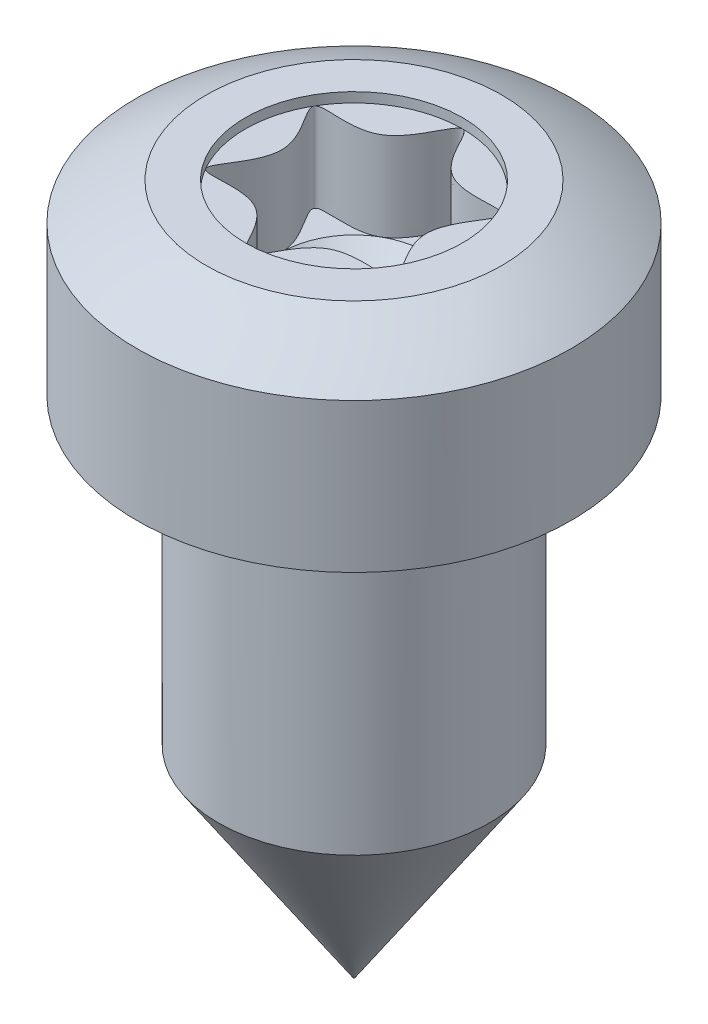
SolidWorks part; units mm, degrees
ref_plane "Front" through (0, 0, 0) normal (0, 0, 1) x (1, 0, 0)
ref_plane "Top" through (0, 0, 0) normal (0, 1, 0) x (1, 0, 0)
ref_plane "Right" through (0, 0, 0) normal (1, 0, 0) x (0, 0, -1)
sketch "Sketch1" plane through (0, 0, 0) normal (0, 0, 1) x (1, 0, 0)
  line L0 (0, 0) -> (0, 9.001) construction
  line L1 (0, 0) -> (0, 8.9)
  line L2 (0, 8.9) -> (2.8, 8.9)
  line L3 (2.8, 8.9) -> (2.8, 6.5)
  line L4 (2.8, 6.5) -> (1.75, 6.5)
  line L5 (1.75, 6.5) -> (1.75, 0)
  line L6 (1.75, 0) -> (0, 0)
  line L7 (0, 8.9) -> (-1.1, 8.9) construction
  line L8 (2.8, 6.5) -> (2.8, 5.4) construction
  line L9 (0, 0) -> (1.75, 2.6) construction
  dimension "head_dia" = 5.6
  dimension "head_ht" = 2.4
  dimension "length" = 6.5
  dimension "dia" = 3.5
  dimension "pitch" = 1.1
  dimension "thread_gap" = 1.1
  dimension "end_length" = 2.6
revolve "Body-Revolve" add sketch "Sketch1" angle 360 about L1
sketch "Sketch3" plane through (0, 0, 0) normal (0, 0, 1) x (1, 0, 0)
  line L0 (2.8, 8.42) -> (0, 4.2775) construction
  line L2 (2.8, 6.5) -> (2.8, 8.9) construction
  line L3 (0, 0) -> (0, 8.9) construction
  line L4 (2.8, 8.9) -> (-2.8, 8.9) construction
  line L5 (0, 9.2775) -> (0, 10.4044)
  line L6 (0, 10.4044) -> (5, 10.4044)
  line L7 (5, 10.4044) -> (5, 4.2775)
  arc A0 (5, 4.2775) -> (0, 9.2775) centre (0, 4.2775) ccw
  dimension "D1" = 0.48
  dimension "sphere_rad" = 5
  dimension "D2" = 1.1268
revolve "Head-Cut-Revolve" cut sketch "Sketch3" angle 360 about axis through (0, 0, 0) along (0, 1, 0)
sketch "Sketch4" plane through (0, 8.9, 0) normal (0, 1, 0) x (-1, 0, 0)
  line L0 (0, 0) -> (0, -1.54)
  line L1 (0, 0) -> (-0.7, -1.2124)
  circle A0 centre (0, 0) radius 1.4
  circle A1 centre (0, 0) radius 0.9333
  spline S0 degree 3 poles (0.302, -0.523) (0, -1.8385) (-0.302, -0.523) (-1.5922, -0.9193) (-0.6039, 0) (-1.5922, 0.9193) (-0.302, 0.523) (0, 1.8385) (0.302, 0.523) (1.5922, 0.9193) (0.6039, 0) (1.5922, -0.9193) (0.302, -0.523) (0, -1.8385) (-0.302, -0.523) knots -0.25 -0.166667 -0.083333 0 0.083333 0.166667 0.25 0.333333 0.416667 0.5 0.583333 0.666667 0.75 0.833333 0.916667 1 1.083333 1.166667 1.25 only from (0, -1.4) to (0, -1.4)
  point P4 (0, -1.4)
  point P7 (-0.4667, -0.8083)
  point P10 (-1.2124, -0.7)
  point P11 (-1.2124, 0.7)
  point P12 (0, 1.4)
  point P13 (1.2124, 0.7)
  point P14 (1.2124, -0.7)
  point P15 (-0.9333, 0)
  point P16 (-0.4667, 0.8083)
  point P17 (0.4667, 0.8083)
  point P18 (0.9333, 0)
  point P19 (0.4667, -0.8083)
  dimension "D1" = 1.8667
  dimension "socket-dia" = 2.8
  dimension "D2" = 30
  dimension "D3" = 1.54
extrude "Recess-Cut-Extrude1" cut sketch "Sketch4" against normal blind 1.27 contours S0
sketch "Sketch5" plane through (0, 8.9, 0) normal (0, 1, 0) x (-1, 0, 0)
  circle A0 centre (0, 0) radius 1.4
  dimension "D1" = 2.8
extrude "Recess-Cut-Extrude2" cut sketch "Sketch5" against normal blind 0.127
sketch "Sketch6" plane through (0, 0, 0) normal (0, 0, 1) x (1, 0, 0)
  line L0 (0, 7.63) -> (0.9333, 7.63)
  line L2 (0, 0) -> (0, 8.9) construction
  line L4 (1.2177, 7.63) -> (-1.2177, 7.63) construction
  line L5 (0.9333, 7.63) -> (0, 6.74)
  line L6 (0, 6.74) -> (0, 7.63)
  line L7 (1.4, 8.9) -> (-1.4, 8.9) construction
  dimension "D1" = 2.16
  dimension "D2" = 0.9333
revolve "Drill-Cut-Revolve" cut sketch "Sketch6" angle 360 about axis through (0, 0, 0) along (0, 1, 0)
fillet "Fillet1" radius 0.1 1 edges at (0, 6.5, -1.75)
sketch "Sketch7" plane through (0, 0, 0) normal (0, 0, 1) x (1, 0, 0)
  line L0 (1.75, 0) -> (1.75, 2.6)
  line L1 (1.75, 0) -> (1.75, 6.4) construction
  line L2 (1.75, 2.6) -> (0.01, 0)
  line L3 (-1.75, 0) -> (1.75, 0) construction
  line L4 (0.01, 0) -> (1.75, 0)
  dimension "D1" = 0.01
  dimension "D2" = 2.6
revolve "Body-Cut-Revolve" cut sketch "Sketch7" angle 360 about axis through (0, 0, 0) along (0, 1, 0)
sketch "Sketch8" plane through (0, 0, 0) normal (0, 0, 1) x (1, 0, 0)
  line L0 (1.75, 5.4) -> (1.75, 4.7125)
  line L1 (1.75, 2.6) -> (1.75, 6.4) construction
  line L2 (1.75, 4.7125) -> (1.1546, 5.0563)
  line L3 (1.1546, 5.0563) -> (1.75, 5.4)
  line L4 (-2.8, 6.5) -> (2.8, 6.5) construction
  line L5 (0, 0) -> (0, 8.9) construction
  dimension "D1" = 1.1
  dimension "D2" = 1.1546
revolve "ThreadSchematic" [suppressed] cut sketch "Sketch8" angle 360 about axis through (0, 0, 0) along (0, 1, 0)
pattern_linear "ThdSchPat" [suppressed] count 5 spacing 1.1 along (0, 1, 0)
equation "\"D1@ThreadCosmetic\" = \"length@Sketch1\" - \"thread_gap@Sketch1\""
equation "\"D2@ThreadCosmetic\" = \"dia@Sketch1\" - \"pitch@Sketch1\" * 1.0825"
equation "\"D1@Sketch3\" = 0.2 * \"head_ht@Sketch1\""
equation "\"D1@Sketch4\" = \"socket-dia@Sketch4\" / 1.5"
equation "\"D3@Sketch4\" = \"socket-dia@Sketch4\" / 2 * 1.1"
equation "\"D1@Sketch5\" = \"socket-dia@Sketch4\""
equation "\"D1@Recess-Cut-Extrude2\" = 0.1 * \"socket-dep@Recess-Cut-Extrude1\""
equation "\"D1@Sketch6\" = 0.9 * \"head_ht@Sketch1\""
equation "\"D2@Sketch6\" = \"D1@Sketch4\" / 2"
equation "\"D2@Sketch7\" = \"end_length@Sketch1\""
equation "\"D1@Sketch8\" = \"thread_gap@Sketch1\""
equation "\"D2@Sketch8\" = \"D2@ThreadCosmetic\" / 2"
equation "\"D3@ThdSchPat\" = \"pitch@Sketch1\""
equation "\"D1@ThdSchPat\" =  ( \"length@Sketch1\" - \"thread_gap@Sketch1\" )  / \"pitch@Sketch1\""
